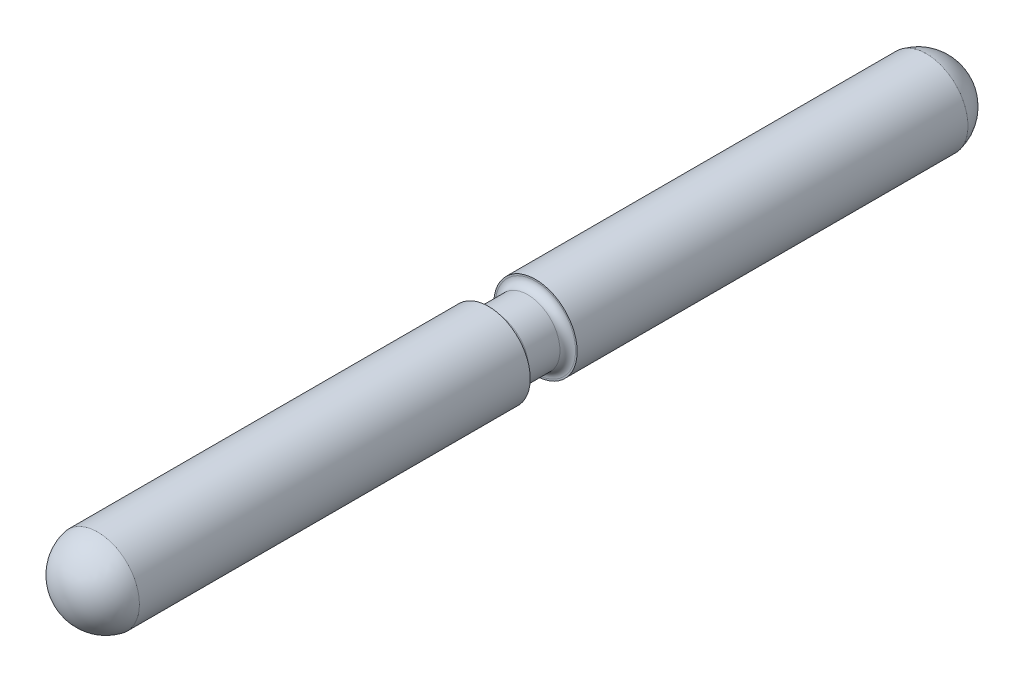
SolidWorks part; units mm, degrees
ref_plane "Plan1" through (0, 0, 0) normal (0, 0, 1) x (1, 0, 0)
ref_plane "Plan2" through (0, 0, 0) normal (0, 1, 0) x (1, 0, 0)
ref_plane "Plan3" through (0, 0, 0) normal (1, 0, 0) x (0, 0, -1)
sketch "Esquisse1" plane through (0, 0, 0) normal (1, 0, 0) x (0, 0, -1)
  line L0 (-100, 0) -> (84, 0) construction
  line L1 (-85.5, 8) -> (-10.5, 8)
  line L2 (-10.5, 8) -> (-10.5, 6.2)
  line L3 (-10.5, 6.2) -> (-1.5, 6.2)
  line L4 (-91.9819, 0) -> (79.9819, 0)
  line L5 (-1.5, 8) -> (-1.5, 6.2)
  line L6 (73.5, 8) -> (-1.5, 8)
  arc A0 (-91.9819, 0) -> (-85.5, 8) centre (-83.9832, 0.1451) cw
  arc A1 (79.9819, 0) -> (73.5, 8) centre (71.9832, 0.1451) ccw
  point P16 (-6, 6.2)
  dimension "D3" = 8
  dimension "D1" = 75
  dimension "D4" = 4.5
revolve "Base-Révolution" add sketch "Esquisse1" angle 360 about L0
fillet "Congé1" radius 1.5
ref_plane "Plan4" through (0, -8, 0) normal (0, -1, 0) x (1, 0, 0)
sketch "Esquisse2" plane through (0, -8, 0) normal (0, -1, 0) x (1, 0, 0)
  point P0 (0, 71.9819)
  dimension "D1" = 20
sketch "Esquisse3" plane through (0, -8, 0) normal (0, -1, 0) x (1, 0, 0)
  point P0 (0, -59.9819)
  dimension "D1" = 20
